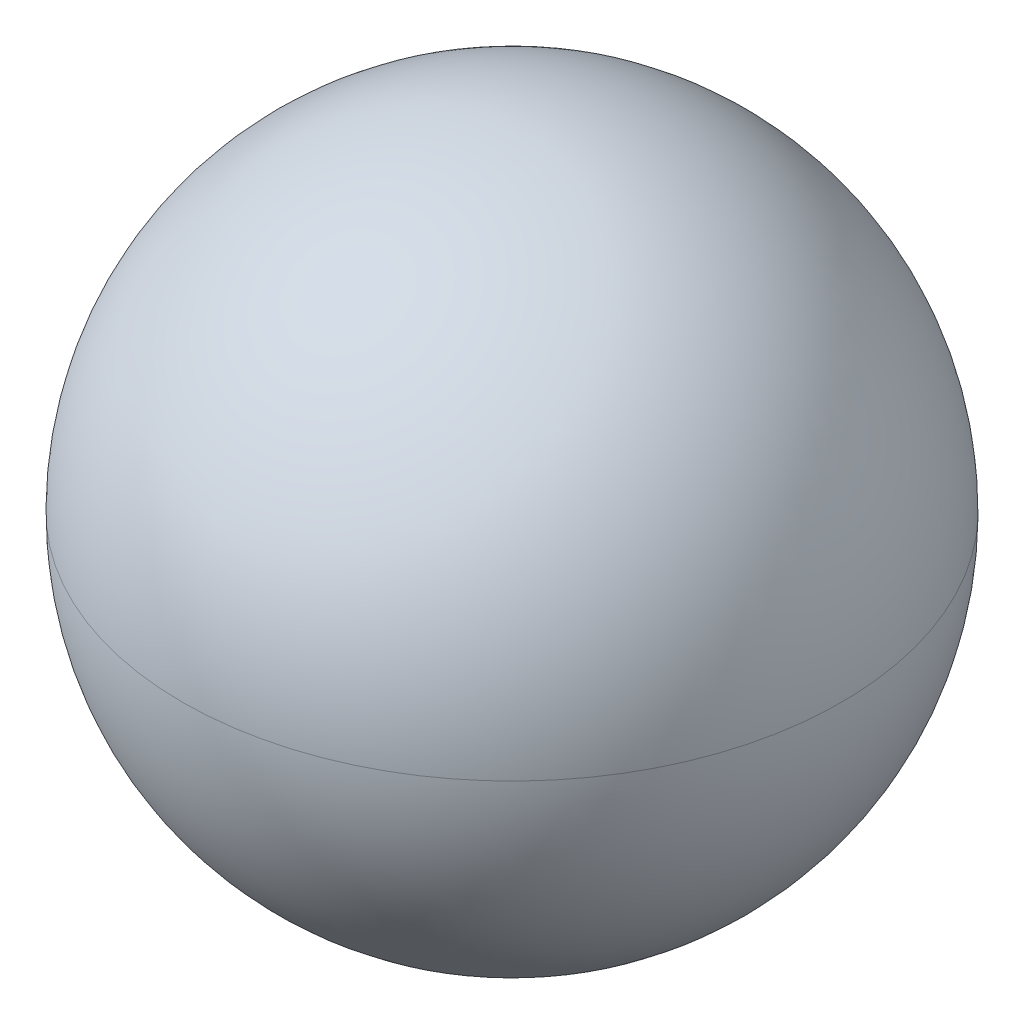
SolidWorks part; units mm, degrees
ref_plane "Plan de face" through (0, 0, 0) normal (0, 0, 1) x (1, 0, 0)
ref_plane "Plan de dessus" through (0, 0, 0) normal (0, 1, 0) x (1, 0, 0)
ref_plane "Plan de droite" through (0, 0, 0) normal (1, 0, 0) x (0, 0, -1)
sketch "Esquisse1" plane through (0, 0, 0) normal (0, 1, 0) x (1, 0, 0)
  circle A0 centre (0, 0) radius 21.5
  dimension "D1" = 43
extrude "Boss.-Extru.1" add sketch "Esquisse1" along normal blind 43
fillet "Congé1" radius 21.5 2 edges at (0, 0, 21.5) (0, 43, 21.5)
